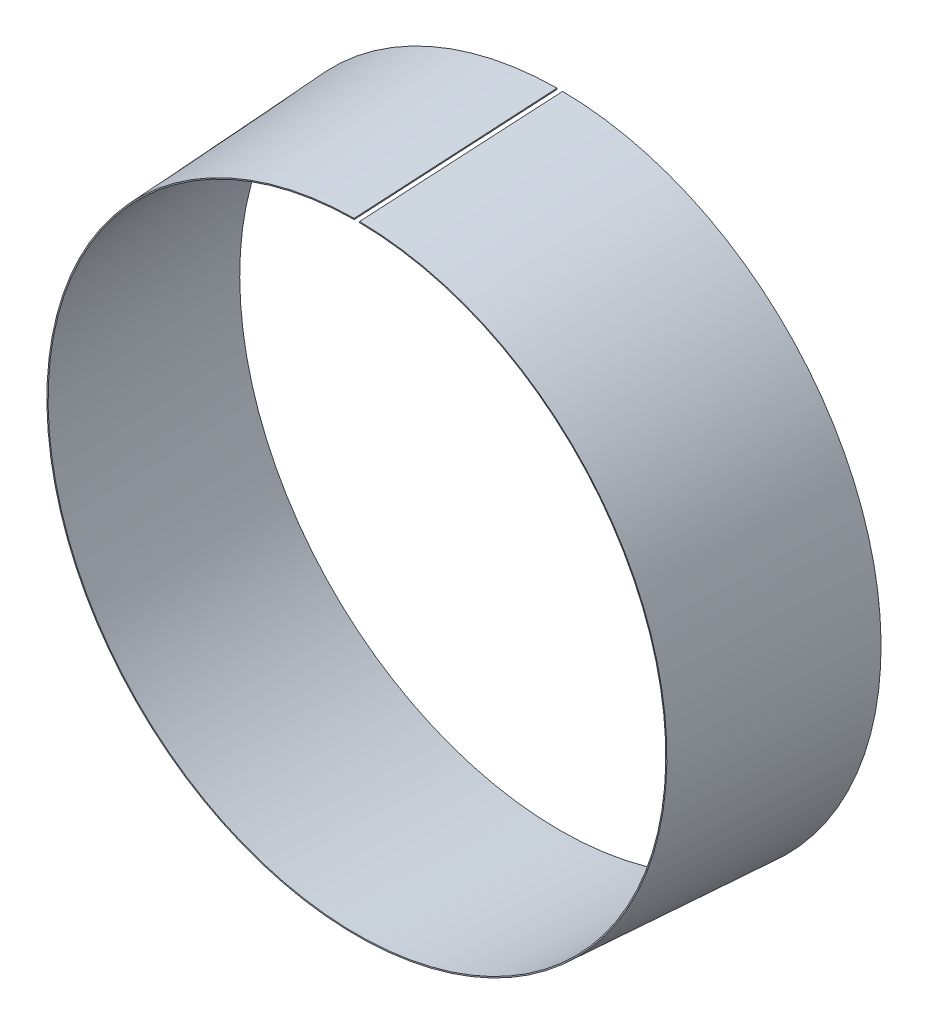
SolidWorks part; units mm, degrees
ref_plane "Ebene vorne" through (0, 0, 0) normal (0, 0, 1) x (1, 0, 0)
ref_plane "Ebene oben" through (0, 0, 0) normal (0, 1, 0) x (1, 0, 0)
ref_plane "Ebene rechts" through (0, 0, 0) normal (1, 0, 0) x (0, 0, -1)
sketch "Skizze1" plane through (0, 0, 0) normal (0, 0, 1) x (1, 0, 0)
  line L0 (0, 0) -> (-2.6181, 300) construction
  line L1 (-2.6181, 300) -> (2.6181, 300) construction
  line L2 (2.6181, 300) -> (0, 0) construction
  arc A0 (-2.4871, 284.9891) -> (2.4871, 284.9891) centre (0, 0) ccw
  dimension "D1" = 570
  dimension "D2" = 1
  dimension "D3" = 300
ref_plane "Ebene1" through (0, 0, 180) normal (0, 0, 1) x (1, 0, 0)
sketch "Skizze2" plane through (0, 0, 180) normal (0, 0, 1) x (1, 0, 0)
  line L1 (0, 0) -> (-2.3998, 274.9895) construction
  line L3 (-2.3998, 274.9895) -> (-2.6181, 300) construction
  line L4 (-2.6181, 300) -> (2.6181, 300) construction
  line L5 (2.6181, 300) -> (0, 0) construction
  arc A0 (-2.3998, 274.9895) -> (2.3998, 274.9895) centre (0, 0) ccw
  dimension "D1" = 550
sheet metal parameters "Blech1" thickness 1 parameters "D1"=1, "Dicke"=1
lofted bend "Ausgeformte Biegungen1" thickness 1 parameters "D1"=0, "D12"=1
other "Freiform-Biegung1" parameters "D1"=1000, "D4"=359, "D5"=1
flat pattern "Abwicklung1"
sketch "Biegung-Linien1" plane through (2.4794, 284.1123, 15.7846) normal (0.0087, 0.9984, 0.0555) x (-1, 0.0087, 0.0005)
  line L0 (-1685.306, 461.1806) -> (-1746.7915, 291.7122) construction
  line L1 (0.0796, 164.4686) -> (-0.0077, -15.809) construction
other "Abwickeln-<Freiform-Biegung1>1"
